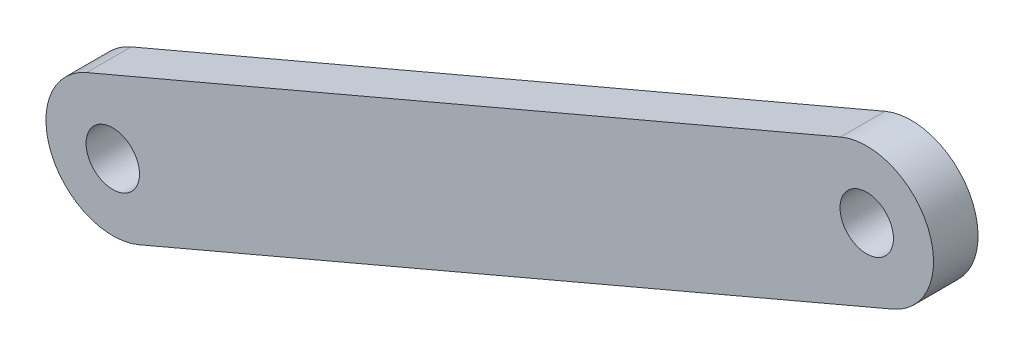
SolidWorks part; units mm, degrees
ref_plane "Plan de face" through (0, 0, 0) normal (0, 0, 1) x (1, 0, 0)
ref_plane "Plan de dessus" through (0, 0, 0) normal (0, 1, 0) x (1, 0, 0)
ref_plane "Plan de droite" through (0, 0, 0) normal (1, 0, 0) x (0, 0, -1)
sketch "Esquisse1" plane through (0, 0, 0) normal (0, 0, 1) x (1, 0, 0)
  line L0 (0, -20) -> (-84.6394, -56.0578) construction
  line L1 (2.9395, -26.9) -> (-81.7, -62.9577)
  line L2 (-2.9395, -13.1) -> (-87.5789, -49.1578)
  arc A0 (2.9395, -26.9) -> (-2.9395, -13.1) centre (0, -20) ccw
  arc A1 (-87.5789, -49.1578) -> (-81.7, -62.9577) centre (-84.6394, -56.0578) ccw
  point P4 (-42.3197, -38.0289)
  dimension "D1" = 15
extrude "Boss.-Extru.1" add sketch "Esquisse1" along normal blind 5 from offset 10
sketch "Esquisse2" plane through (0, 0, -5) normal (0, 0, 1) x (1, 0, 0)
  circle A0 centre (0, -20) radius 3
  circle A1 centre (-84.6394, -56.0578) radius 3
  dimension "D1" = 6
  dimension "D2" = 6
extrude "Enlèv. mat.-Extru.1" cut sketch "Esquisse2" against normal up to vertex (5 mm away) contours A1 | A0
